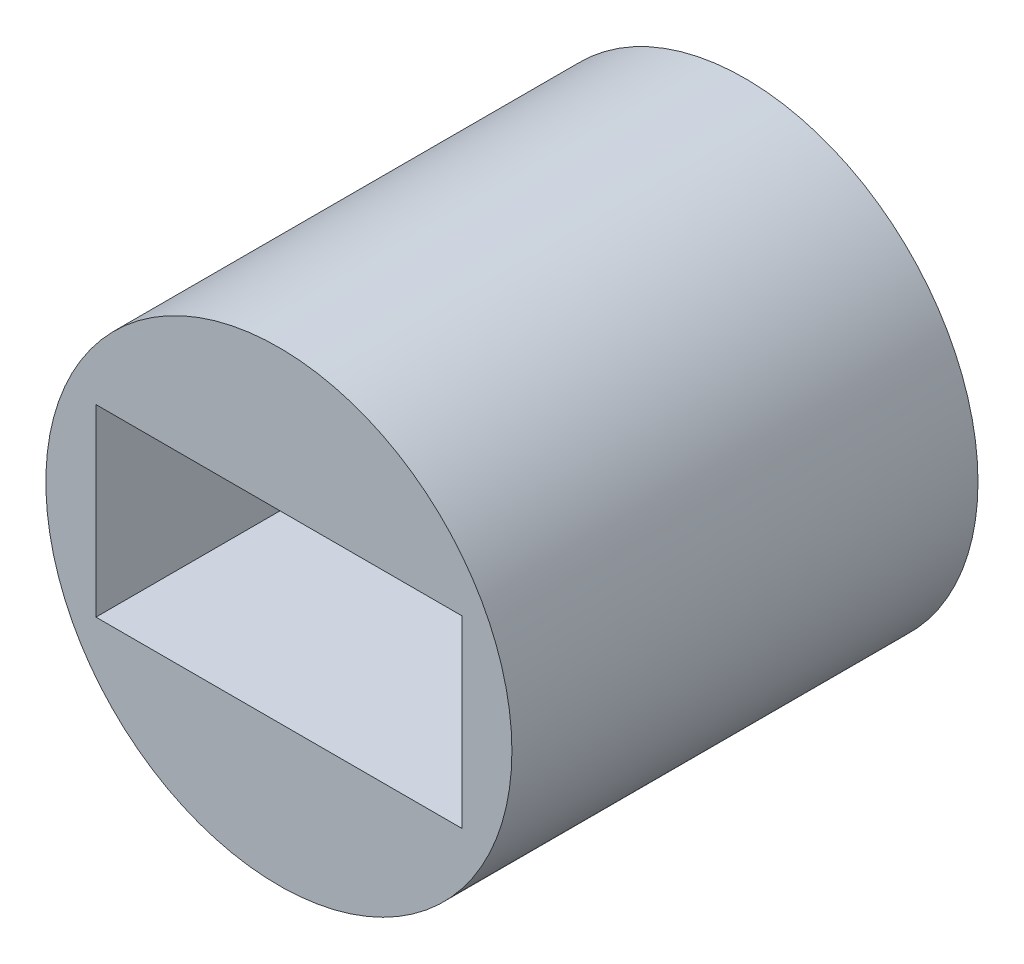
SolidWorks part; units mm, degrees
ref_plane "Front Plane" through (0, 0, 0) normal (0, 0, 1) x (1, 0, 0)
ref_plane "Top Plane" through (0, 0, 0) normal (0, 1, 0) x (1, 0, 0)
ref_plane "Right Plane" through (0, 0, 0) normal (1, 0, 0) x (0, 0, -1)
sketch "Sketch2" plane through (0, 0, 0) normal (0, 0, 1) x (1, 0, 0)
  circle A0 centre (0, 0) radius 25.4
  dimension "D1" = 50.8
extrude "Boss-Extrude1" add sketch "Sketch2" along normal blind 50.8
sketch "Sketch3" plane through (0, 0, 50.8) normal (0, 0, 1) x (1, 0, 0)
  line L0 (0, 0) -> (19.939, 0)
  line L1 (0, 0) -> (-19.939, 0)
  line L2 (-19.939, 0) -> (-19.939, 10.033)
  line L4 (-19.939, 10.033) -> (19.939, 10.033)
  line L5 (-19.939, 10.033) -> (-19.939, -10.033)
  line L6 (-19.939, -10.033) -> (19.939, -10.033)
  line L7 (19.939, 10.033) -> (19.939, -10.033)
  dimension "D1" = 19.939
  dimension "D2" = 10.033
  dimension "D3" = 20.066
extrude "Cut-Extrude1" cut sketch "Sketch3" against normal blind 35.56 contours L5 L4 L7 L6
